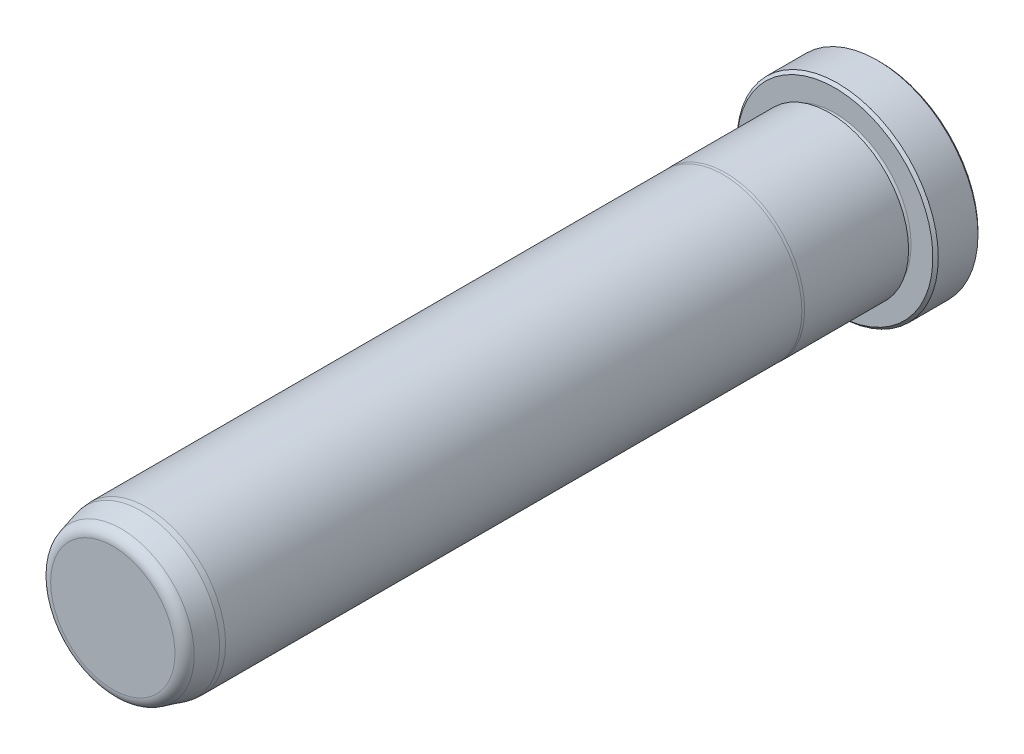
SolidWorks part; units mm, degrees
ref_plane "Front Plane" through (0, 0, 0) normal (0, 0, 1) x (1, 0, 0)
ref_plane "Top Plane" through (0, 0, 0) normal (0, 1, 0) x (1, 0, 0)
ref_plane "Right Plane" through (0, 0, 0) normal (1, 0, 0) x (0, 0, -1)
sketch "Sketch1" plane through (0, 0, 0) normal (1, 0, 0) x (0, 0, -1)
  line L0 (0, 0) -> (0, 14.1605)
  line L1 (0, 14.1605) -> (-6.35, 14.1605)
  line L2 (-6.35, 14.1605) -> (-6.35, 10.7188)
  line L3 (-6.35, 10.3378) -> (-7.112, 10.3378) construction
  line L4 (-7.112, 10.7188) -> (-7.112, 11.1252)
  line L5 (-7.112, 11.1252) -> (-21.7348, 11.1252)
  line L6 (-21.7348, 11.1252) -> (-22.098, 11.0998)
  line L7 (-22.098, 11.0998) -> (-103.1875, 11.0998)
  line L9 (-107.95, 9.9612) -> (-107.95, 0)
  line L10 (-107.95, 0) -> (0, 0)
  line L11 (0, 0) -> (13.6287, 0) construction
  line L12 (-103.1875, 11.0998) -> (-103.9495, 11.0331)
  line L13 (-103.9495, 11.0331) -> (-107.95, 9.9612)
  arc A0 (-7.112, 10.7188) -> (-6.35, 10.7188) centre (-6.731, 10.7188) ccw
  dimension "D14" = 0.762
  dimension "D1" = 6.35
  dimension "D2" = 0.762
  dimension "D3" = 28.321
  dimension "D4" = 22.2504
  dimension "D5" = 22.098
  dimension "D6" = 107.95
  dimension "D7" = 0.7874
  dimension "D8" = 4
  dimension "D9" = 22.1996
  dimension "D10" = 5
  dimension "D11" = 15
  dimension "D12" = 0.762
  dimension "D13" = 4.7625
revolve "Revolve1" add sketch "Sketch1" angle 360 about L11
fillet "Fillet6" radius 1.5875 1 edges at (9.9612, 0, 107.95)
chamfer "Chamfer1" distance 0.381 angle 45 2 edges at (14.1605, 0, 0) (14.1605, 0, 6.35)
